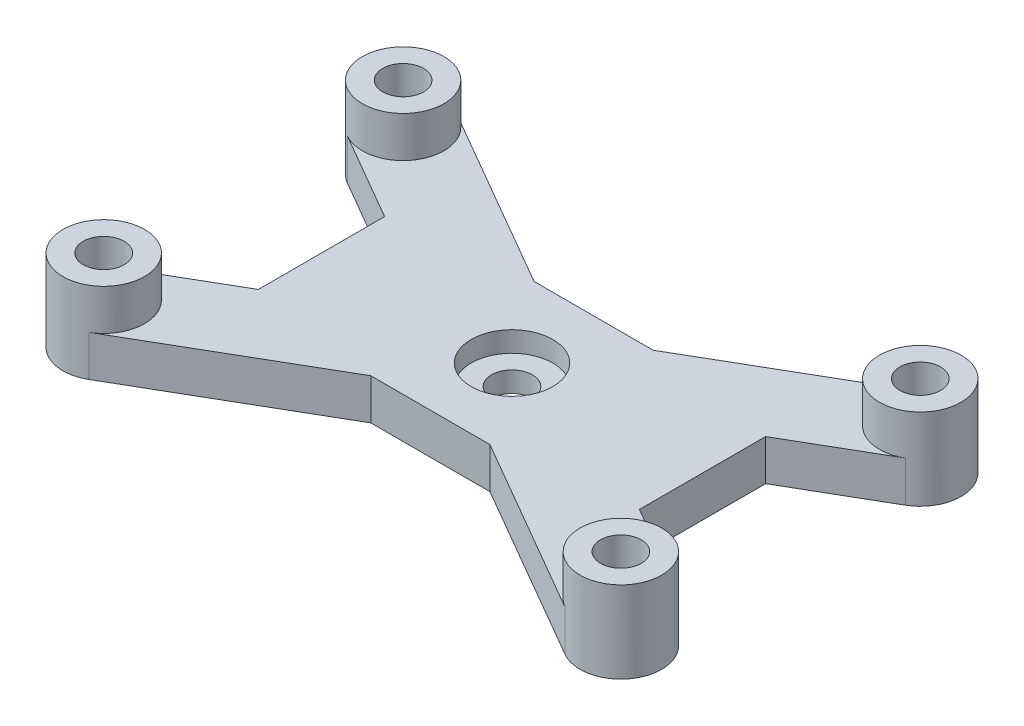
SolidWorks part; units mm, degrees
ref_plane "Plano frontal" through (0, 0, 0) normal (0, 0, 1) x (1, 0, 0)
ref_plane "Plano superior" through (0, 0, 0) normal (0, 1, 0) x (1, 0, 0)
ref_plane "Plano direito" through (0, 0, 0) normal (1, 0, 0) x (0, 0, -1)
sketch "Esboço1" plane through (0, 0, 0) normal (0, 1, 0) x (1, 0, 0)
  line L0 (-13.0711, 4.2541) -> (-6.568, 0.4891)
  line L5 (-10.0649, 9.4466) -> (3.0559, 1.8503)
  line L6 (-13.0711, -12.5534) -> (-6.568, -8.7884)
  line L7 (-10.0649, -17.7459) -> (3.0559, -10.1497)
  line L8 (3.0559, 1.8503) -> (11.808, 1.8503)
  line L9 (21.432, 0.4891) -> (21.432, -8.7884)
  line L10 (3.0559, -10.1497) -> (11.808, -10.1497)
  line L11 (-6.568, 0.4891) -> (-6.568, -8.7884)
  line L14 (11.808, -10.1497) -> (24.9289, -17.7459)
  line L15 (21.432, -8.7884) -> (27.9351, -12.5534)
  line L16 (21.432, 0.4891) -> (27.9351, 4.2541)
  line L17 (11.808, 1.8503) -> (24.9289, 9.4466)
  circle A0 centre (-11.568, 6.8503) radius 1.5
  circle A1 centre (26.432, 6.8503) radius 1.5
  circle A2 centre (-11.568, -15.1497) radius 1.5
  circle A3 centre (26.432, -15.1497) radius 1.5
  arc A4 (-10.0649, 9.4466) -> (-13.0711, 4.2541) centre (-11.568, 6.8503) ccw
  arc A5 (27.9351, 4.2541) -> (24.9289, 9.4466) centre (26.432, 6.8503) ccw
  arc A6 (24.9289, -17.7459) -> (27.9351, -12.5534) centre (26.432, -15.1497) ccw
  arc A7 (-13.0711, -12.5534) -> (-10.0649, -17.7459) centre (-11.568, -15.1497) ccw
  circle A8 centre (7.432, -4.1497) radius 1.5
  point P24 (7.432, -4.1497)
  dimension "D3" = 3
  dimension "D4" = 6
  dimension "D5" = 3
  dimension "D1" = 38
  dimension "D2" = 22
extrude "Ressalto-extrusão1" add sketch "Esboço1" along normal blind 3
sketch "Esboço2" plane through (0, 3, 0) normal (0, 1, 0) x (1, 0, 0)
  circle A0 centre (7.432, -4.1497) radius 3
  dimension "D1" = 6
extrude "Corte-extrusão1" cut sketch "Esboço2" against normal blind 1.5
sketch "Esboço3" plane through (0, 3, 0) normal (0, 1, 0) x (1, 0, 0)
  circle A0 centre (-11.568, 6.8503) radius 1.5
  circle A1 centre (-11.568, 6.8503) radius 3
  circle A2 centre (26.432, 6.8503) radius 1.5
  circle A3 centre (26.432, 6.8503) radius 3
  circle A4 centre (26.432, -15.1497) radius 1.5
  circle A5 centre (26.432, -15.1497) radius 3
  circle A6 centre (-11.568, -15.1497) radius 1.5
  circle A7 centre (-11.568, -15.1497) radius 3
extrude "Ressalto-extrusão2" add sketch "Esboço3" along normal blind 3
